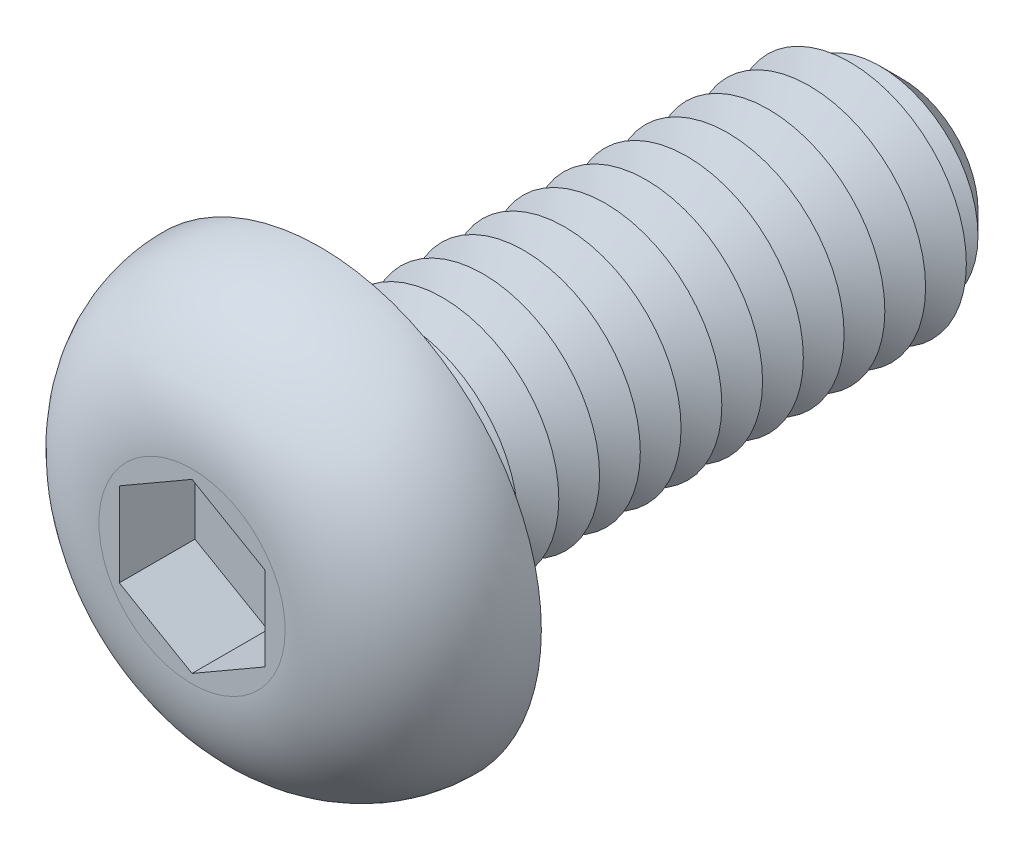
SolidWorks part; units mm, degrees
ref_plane "Front Plane" through (0, 0, 0) normal (0, 0, 1) x (1, 0, 0)
ref_plane "Top Plane" through (0, 0, 0) normal (0, 1, 0) x (1, 0, 0)
ref_plane "Right Plane" through (0, 0, 0) normal (1, 0, 0) x (0, 0, -1)
sketch "Sketch1" plane through (0, 0, 0) normal (1, 0, 0) x (0, 0, -1)
  line L0 (-47.9342, 0) -> (60.3146, 0) construction
sketch "Sketch2" plane through (0, 0, 0) normal (1, 0, 0) x (0, 0, -1)
  line L0 (0, 0) -> (-2.2, 0)
  line L1 (-47.9342, 0) -> (60.3146, 0) construction
  line L2 (-2.2, 0) -> (-2.2, 1.6)
  line L3 (0, 3.8) -> (0, 0)
  arc A0 (-2.2, 1.6) -> (0, 3.8) centre (0, 1.6) cw
  dimension "D1" = 2.2
  dimension "D2" = 2.2
  dimension "D3" = 3.8
revolve "Revolve1" add sketch "Sketch2" angle 360 about L0
sketch "Sketch3" plane through (0, 0, 2.2) normal (0, 0, 1) x (1, 0, 0)
  line L1 (0, 1.4434) -> (-1.25, 0.7217)
  line L2 (-1.25, 0.7217) -> (-1.25, -0.7217)
  line L3 (-1.25, -0.7217) -> (0, -1.4434)
  line L4 (0, -1.4434) -> (1.25, -0.7217)
  line L5 (1.25, -0.7217) -> (1.25, 0.7217)
  line L6 (1.25, 0.7217) -> (0, 1.4434)
  circle A0 centre (0, 0) radius 1.25 construction
  dimension "D1" = 2.5
extrude "Cut-Extrude1" cut sketch "Sketch3" against normal blind 1.3
sketch "Sketch4" plane through (0, 0, 0) normal (0, 0, -1) x (-1, 0, 0)
  circle A0 centre (0, 0) radius 2
  dimension "D1" = 4
extrude "Boss-Extrude1" add sketch "Sketch4" along normal blind 10
chamfer "Chamfer1" distance 0.7 angle 45 1 edges at (-2, 0, -10)
sketch "Sketch5" plane through (0, 0, 0) normal (1, 0, 0) x (0, 0, -1)
  line L0 (0.7, 2) -> (1.4, 2)
  line L1 (9.3, 2) -> (0, 2) construction
  line L2 (1.4, 2) -> (1.05, 1.3938)
  line L3 (1.05, 1.3938) -> (0.7, 2)
  line L4 (0, -3.8) -> (0, 3.8) construction
  line L5 (9.3, 2) -> (0, 2) construction
  dimension "D1" = 0.7
  dimension "D2" = 0.7
revolve "Cut-Revolve1" cut sketch "Sketch5" angle 360 about L0
pattern_linear "LPattern1" count 13 spacing 0.7 along (0, 0, -1) of "Cut-Revolve1"
fillet "Fillet2" radius 0.35 1 edges at (2, 0, 0)
sketch "Sketch6" plane through (0, 0, 0.9) normal (0, 0, 1) x (1, 0, 0)
  circle A0 centre (0, 0) radius 0.5
  dimension "D1" = 1
extrude "Cut-Extrude2" cut sketch "Sketch6" against normal up to surface (10.9 mm away)
